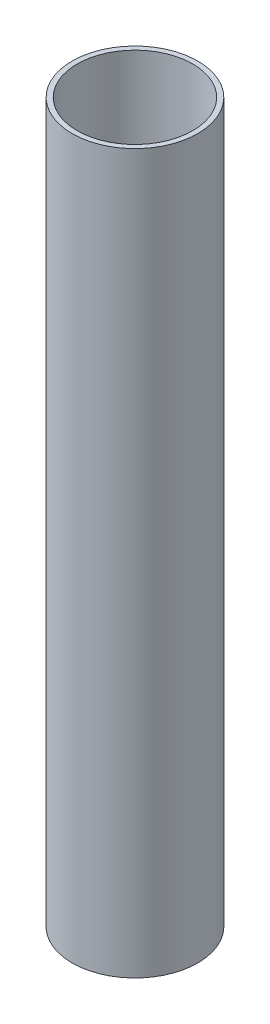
SolidWorks part; units mm, degrees
ref_plane "Front Plane" through (0, 0, 0) normal (0, 0, 1) x (1, 0, 0)
ref_plane "Top Plane" through (0, 0, 0) normal (0, 1, 0) x (1, 0, 0)
ref_plane "Right Plane" through (0, 0, 0) normal (1, 0, 0) x (0, 0, -1)
sketch "Sketch1" plane through (0, 0, 0) normal (0, 1, 0) x (1, 0, 0)
  circle A0 centre (0, 0) radius 11.1125
  dimension "D1" = 22.225
extrude "Extrude-Thin1" add sketch "Sketch1" along normal mid plane 127 thin
